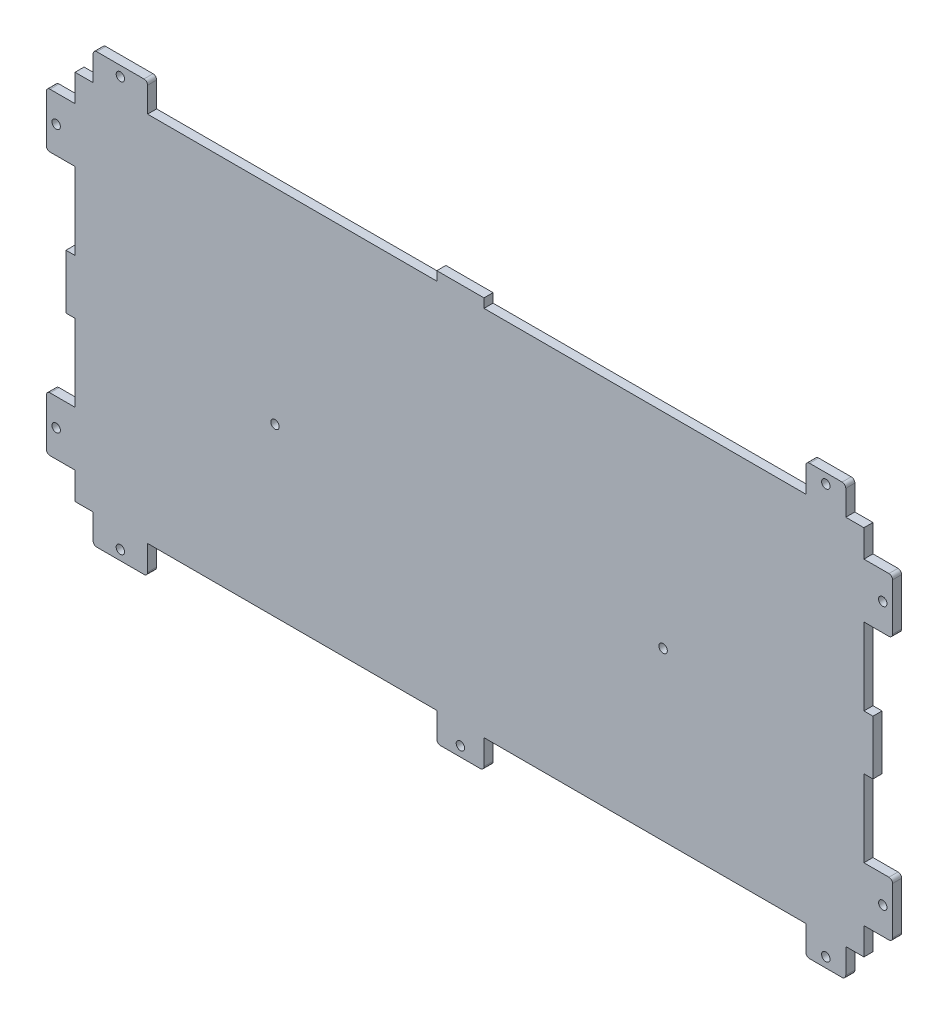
SolidWorks part; units mm, degrees
ref_plane "Front Plane" through (0, 0, 0) normal (0, 0, 1) x (1, 0, 0)
ref_plane "Top Plane" through (0, 0, 0) normal (0, 1, 0) x (1, 0, 0)
ref_plane "Right Plane" through (0, 0, 0) normal (1, 0, 0) x (0, 0, -1)
sketch "Sketch1" plane through (0, 0, 0) normal (0, 0, 1) x (1, 0, 0)
  line L1 (0, 0) -> (276.225, 0)
  line L2 (0, 0) -> (0, 130.175)
  line L3 (0, 130.175) -> (276.225, 130.175)
  line L4 (276.225, 0) -> (276.225, 130.175)
  dimension "D1" = 276.225
  dimension "D2" = 130.175
extrude "Boss-Extrude1" add sketch "Sketch1" along normal blind 3.175
sketch "Sketch2" plane through (0, 0, 0) normal (0, 0, 1) x (1, 0, 0)
  line L1 (138.1125, 130.175) -> (138.1125, 0) construction
  line L2 (276.225, 130.175) -> (0, 130.175) construction
  line L3 (0, 0) -> (276.225, 0) construction
  line L4 (276.225, 65.0875) -> (0, 65.0875) construction
  line L5 (126.6825, 130.175) -> (143.1925, 130.175)
  line L6 (276.225, 0) -> (276.225, 130.175) construction
  line L7 (0, 130.175) -> (0, 0) construction
  line L8 (286.258, 9.525) -> (286.258, 28.575)
  line L9 (276.225, 120.65) -> (286.258, 120.65)
  line L10 (276.225, 120.65) -> (276.225, 101.6)
  line L11 (276.225, 101.6) -> (286.258, 101.6)
  line L12 (286.258, 120.65) -> (286.258, 101.6)
  line L13 (276.225, 74.6125) -> (279.4, 74.6125)
  line L14 (276.225, 74.6125) -> (276.225, 55.5625)
  line L15 (126.6825, 130.175) -> (126.6825, 133.35)
  line L16 (276.225, 55.5625) -> (279.4, 55.5625)
  line L17 (279.4, 74.6125) -> (279.4, 55.5625)
  line L18 (276.225, 28.575) -> (286.258, 28.575)
  line L19 (276.225, 9.525) -> (276.225, 28.575)
  line L20 (276.225, 9.525) -> (286.258, 9.525)
  line L21 (0, 9.525) -> (-10.033, 9.525)
  line L22 (0, 9.525) -> (0, 28.575)
  line L23 (0, 28.575) -> (-10.033, 28.575)
  line L24 (-3.175, 74.6125) -> (-3.175, 55.5625)
  line L25 (0, 55.5625) -> (-3.175, 55.5625)
  line L26 (0, 74.6125) -> (0, 55.5625)
  line L27 (0, 74.6125) -> (-3.175, 74.6125)
  line L28 (-10.033, 120.65) -> (-10.033, 101.6)
  line L29 (0, 101.6) -> (-10.033, 101.6)
  line L30 (0, 120.65) -> (0, 101.6)
  line L31 (0, 120.65) -> (-10.033, 120.65)
  line L32 (-10.033, 9.525) -> (-10.033, 28.575)
  line L33 (126.6825, 133.35) -> (143.1925, 133.35)
  line L34 (6.35, 0) -> (25.4, 0)
  line L35 (6.35, 0) -> (6.35, -10.033)
  line L36 (6.35, -10.033) -> (25.4, -10.033)
  line L37 (25.4, 0) -> (25.4, -10.033)
  line L38 (126.6825, 0) -> (143.1925, 0)
  line L39 (126.6825, 0) -> (126.6825, -10.033)
  line L40 (126.6825, -10.033) -> (143.1925, -10.033)
  line L41 (143.1925, 130.175) -> (143.1925, 133.35)
  line L42 (143.1925, 0) -> (143.1925, -10.033)
  line L44 (255.905, 0) -> (269.875, 0)
  line L45 (255.905, 0) -> (255.905, -10.033)
  line L46 (255.905, -10.033) -> (269.875, -10.033)
  line L47 (269.875, 0) -> (269.875, -10.033)
  line L48 (6.35, 130.175) -> (25.4, 130.175)
  line L49 (6.35, 130.175) -> (6.35, 140.208)
  line L50 (6.35, 140.208) -> (25.4, 140.208)
  line L51 (25.4, 130.175) -> (25.4, 140.208)
  line L52 (255.905, 130.175) -> (269.875, 130.175)
  line L53 (255.905, 130.175) -> (255.905, 140.208)
  line L54 (255.905, 140.208) -> (269.875, 140.208)
  line L55 (269.875, 130.175) -> (269.875, 140.208)
  point P20 (276.225, 65.0875)
  point P49 (134.9375, -10.033)
  dimension "D1" = 19.05
  dimension "D2" = 9.525
  dimension "D3" = 10.033
  dimension "D4" = 10.033
  dimension "D5" = 6.35
  dimension "D6" = 6.35
  dimension "D7" = 3.175
  dimension "D8" = 19.05
  dimension "D9" = 16.51
  dimension "D10" = 13.97
  dimension "D11" = 10.033
  dimension "D12" = 3.175
  dimension "D13" = 3.175
extrude "Boss-Extrude2" add sketch "Sketch2" along normal blind 3.175
hole_wizard "#4 Clearance Hole1" positions "Sketch5" profile "Sketch4" hole size "#4" standard "ANSI Inch"
sketch "Sketch5" plane through (0, 0, 3.175) normal (0, 0, 1) x (1, 0, 0)
  line L11 (25.4, 0) -> (126.6825, 0) construction
  line L12 (143.1925, 0) -> (255.905, 0) construction
  line L13 (126.6825, -10.033) -> (143.1925, -10.033) construction
  line L14 (-3.175, 65.0875) -> (279.4, 65.0875) construction
  line L15 (-3.175, 74.6125) -> (-3.175, 55.5625) construction
  line L16 (279.4, 55.5625) -> (279.4, 74.6125) construction
  line L18 (6.35, -10.033) -> (25.4, -10.033) construction
  line L19 (255.905, -10.033) -> (269.875, -10.033) construction
  line L20 (286.258, 101.6) -> (286.258, 120.65) construction
  line L21 (276.225, 74.6125) -> (276.225, 101.6) construction
  line L22 (138.1125, 23.6458) -> (138.1125, 106.5292) construction
  point P0 (70.0139, 58.42)
  point P2 (205.9039, 58.42)
  point P7 (134.9375, -6.604)
  point P65 (134.9375, -10.033)
  point P66 (15.875, -6.604)
  point P68 (262.89, -6.604)
  point P80 (15.875, -10.033)
  point P83 (262.89, -10.033)
  point P85 (262.89, 136.779)
  point P86 (15.875, 136.779)
  point P87 (282.829, 111.125)
  point P91 (286.258, 111.125)
  point P95 (282.829, 19.05)
  point P99 (138.1125, 65.0875)
  point P100 (138.1125, 65.0875)
  point P101 (-6.604, 111.125)
  point P102 (-6.604, 19.05)
  dimension "D1" = 135.89
  dimension "D2" = 58.42
  dimension "D3" = 6.604
  dimension "D4" = 64.9236
  dimension "D5" = 6.604
sketch "Sketch4" plane through (70.0139, 58.42, 3.175) normal (1, 0, 0) x (0, -1, 0)
  line L0 (0, 0) -> (0, 3.302)
  line L1 (0, 3.302) -> (1.4732, 3.302)
  line L2 (1.4732, 3.302) -> (1.4732, 0)
  line L5 (1.4732, 0) -> (0, 0)
  line L10 (0, 3.302) -> (-1.4732, 3.302) construction
  line L11 (0, -6.35) -> (0, 107.95) construction
  dimension "Hole Dia." = 2.9464
  dimension "Hole Depth" = 3.302
  dimension "Drill Angle" = 180
fillet "Fillet1" radius 1.27 18 edges at (6.35, 140.208, 1.5875) (25.4, 140.208, 1.5875) (255.905, 140.208, 1.5875) (269.875, 140.208, 1.5875) (269.875, -10.033, 1.5875) (255.905, -10.033, 1.5875) (143.1925, -10.033, 1.5875) (126.6825, -10.033, 1.5875) (25.4, -10.033, 1.5875) (6.35, -10.033, 1.5875) (-10.033, 120.65, 1.5875) (-10.033, 28.575, 1.5875) (-10.033, 101.6, 1.5875) (-10.033, 9.525, 1.5875) (286.258, 120.65, 1.5875) (286.258, 101.6, 1.5875) (286.258, 28.575, 1.5875) (286.258, 9.525, 1.5875)
